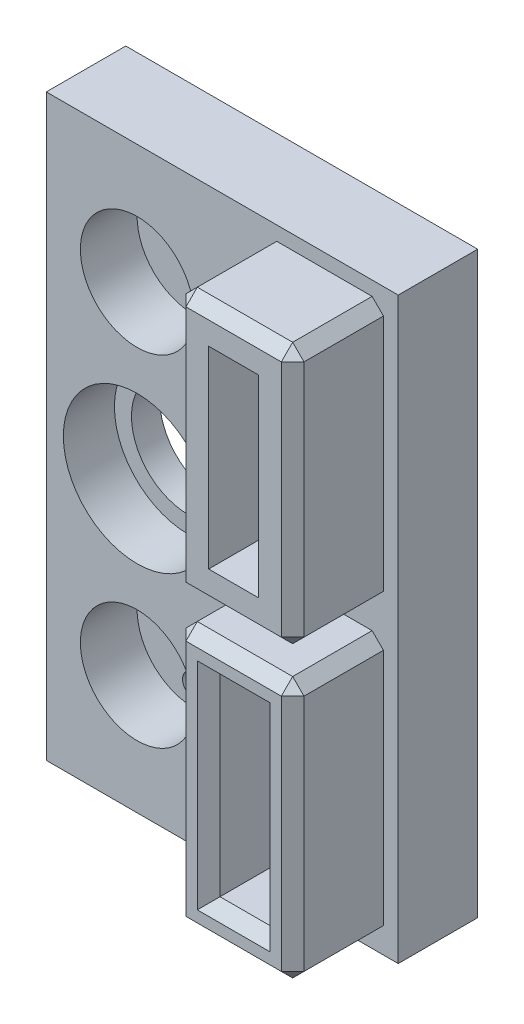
SolidWorks part; units mm, degrees
ref_plane "前视基准面" through (0, 0, 0) normal (0, 0, 1) x (1, 0, 0)
ref_plane "上视基准面" through (0, 0, 0) normal (0, 1, 0) x (1, 0, 0)
ref_plane "右视基准面" through (0, 0, 0) normal (1, 0, 0) x (0, 0, -1)
sketch "草图1" plane through (0, 0, 0) normal (0, 0, 1) x (1, 0, 0)
  line L0 (0, 0) -> (0, 15)
  line L1 (22.82, 25.8) -> (22.82, 25.5)
  line L2 (-8, 25.8) -> (22.82, 25.8)
  line L3 (-8, 25.8) -> (-8, -25.8)
  line L4 (-8, 25.8) -> (-8, -25.8)
  line L5 (-8, 25.8) -> (-8, 7.0376)
  line L6 (-8, -25.8) -> (22.82, -25.8)
  line L7 (0, 15) -> (0, -15)
  line L8 (-5, 15) -> (-8, 15)
  line L9 (-8, 15) -> (-8, 28.4964)
  line L10 (-8, 28.4964) -> (-8, -25.8)
  line L12 (22.82, 25.8) -> (22.82, -25.8)
  line L13 (-8, 25.8) -> (-8, -25.8)
  circle A0 centre (0, 15) radius 5
  circle A1 centre (0, -15) radius 5
  circle A2 centre (0, 0) radius 3
  point P0 (0, 0)
extrude "凸台-拉伸1" add sketch "草图1" along normal blind 5
sketch "草图4" plane through (0, 0, 0) normal (0, 0, -1) x (-1, 0, 0)
  line L1 (-22.8233, 25.8) -> (8, 25.8)
  line L2 (-22.8233, 25.8) -> (-22.8233, -25.8)
  line L3 (-22.8233, -25.8) -> (8, -25.8)
  line L4 (8, 25.8) -> (8, -25.8)
extrude "凸台-拉伸4" add sketch "草图4" along normal blind 2
sketch "草图5" plane through (0, 0, 0) normal (0, 0, 1) x (1, 0, 0)
  circle A0 centre (0, 0) radius 3
extrude "切除-拉伸1" cut sketch "草图5" against normal blind 10
sketch "草图6" plane through (0, 0, -2) normal (0, 0, -1) x (-1, 0, 0)
  circle A0 centre (0, 0) radius 5
extrude "切除-拉伸2" cut sketch "草图6" against normal blind 2.6
sketch "草图7" plane through (0, 0, 5) normal (0, 0, 1) x (1, 0, 0)
  circle A0 centre (0, 0) radius 6.5
extrude "切除-拉伸3" cut sketch "草图7" against normal blind 4.5
sketch "草图8" plane through (0, 0, 0) normal (0, 0, 1) x (1, 0, 0)
  circle A0 centre (0, 15) radius 1
  circle A1 centre (0, -15) radius 1
extrude "切除-拉伸4" cut sketch "草图8" against normal blind 10
sketch "草图11" plane through (0, 0, -2) normal (0, 0, -1) x (-1, 0, 0)
  line L0 (0, -15) -> (0, -18.3)
  circle A0 centre (0, -18.3) radius 1
extrude "切除-拉伸6" cut sketch "草图11" against normal blind 11
sketch "草图12" plane through (0, 0, 5) normal (0, 0, 1) x (1, 0, 0)
  line L1 (-8, -25.8) -> (22.82, -25.8)
  line L2 (-8, -25.8) -> (-8, -25.32)
  line L3 (-8, -25.32) -> (22.71, -25.32)
  line L4 (22.9793, 25.68) -> (22.71, 26.0175)
  line L5 (22.71, 25.8) -> (22.71, 31.08)
  line L6 (22.82, -25.8) -> (22.71, -25.8)
  line L7 (22.8835, 25.8) -> (26.1415, 25.8)
  line L8 (22.82, 31.08) -> (22.71, 31.08)
  line L9 (22.71, -25.32) -> (22.71, 25.68)
  line L10 (-8, 25.8) -> (22.71, 25.8)
  line L11 (-8, 25.8) -> (-8, 25.68)
  line L12 (-8, 25.68) -> (22.71, 25.68)
  line L13 (26.1415, 25.8) -> (26.1415, 25.68)
  line L14 (22.9793, 25.68) -> (26.1415, 25.68)
  line L16 (22.9793, 25.68) -> (33.8743, 25.68)
  line L18 (22.82, -25.8) -> (33.8743, -25.8)
  line L19 (33.8743, 25.68) -> (33.8743, -25.8)
extrude "切除-拉伸7" cut sketch "草图12" against normal blind 11
sketch "草图14" plane through (0, 0, -2) normal (0, 0, -1) x (-1, 0, 0)
  line L1 (-22.71, 25.68) -> (-23, 25.68)
  line L2 (-22.71, 25.68) -> (-22.71, -25.32)
  line L3 (-22.71, -25.32) -> (-23, -25.32)
  line L4 (-23, 25.68) -> (-23, -25.32)
extrude "凸台-拉伸7" add sketch "草图14" against normal up to surface (7 mm away)
sketch "草图15" plane through (0, 0, 5) normal (0, 0, 1) x (1, 0, 0)
  line L0 (0, 0) -> (23, 0)
  line L2 (23, 0) -> (23, 25.5)
  line L3 (23, 25.68) -> (23, -25.32) construction
  line L4 (23, 25.5) -> (-10.6575, 25.5)
  line L5 (-10.6575, 25.5) -> (-9.8194, 24.662)
  line L6 (23, 25.68) -> (-10.6575, 25.68)
  line L7 (23, 25.68) -> (23, 25.5)
  line L8 (23, 25.5) -> (-10.6575, 25.5)
  line L9 (-10.6575, 25.68) -> (-10.6575, 25.5)
extrude "切除-拉伸8" cut sketch "草图15" against normal blind 10 contours L6 L9 L4 M4 | L4 M6 M7 M4
sketch "草图16" plane through (0, 0, 5) normal (0, 0, 1) x (1, 0, 0)
  line L0 (-8, -25.32) -> (23, -25.32) construction
  line L1 (-8, 25.5) -> (23, 25.5)
  line L2 (-8, 25.5) -> (-8, -25.5)
  line L3 (-8, -25.5) -> (23, -25.5)
  line L4 (23, 25.5) -> (23, -25.5)
  line L5 (-8, -25.32) -> (23, -25.32)
extrude "凸台-拉伸8" add sketch "草图16" against normal up to surface (7 mm away) contours L4 L2 L3 M23
sketch "草图17" plane through (0, 0, 5) normal (0, 0, 1) x (1, 0, 0)
  line L0 (18.7, -21.25) -> (14.3, -21.25)
  line L1 (21.7, -24.25) -> (11.3, -24.25)
  line L2 (21.7, -24.25) -> (21.7, -1.25)
  line L3 (21.7, -1.25) -> (11.3, -1.25)
  line L4 (11.3, -24.25) -> (11.3, -1.25)
  line L5 (21.7, 1.25) -> (11.3, 1.25)
  line L6 (21.7, 1.25) -> (21.7, 24.25)
  line L7 (21.7, 24.25) -> (11.3, 24.25)
  line L8 (11.3, 1.25) -> (11.3, 24.25)
  line L9 (14.3, -21.25) -> (14.3, -4.25)
  line L10 (18.7, -4.25) -> (14.3, -4.25)
  line L11 (18.7, -21.25) -> (18.7, -4.25)
  line L12 (18.7, 4.25) -> (14.3, 4.25)
  line L13 (14.3, 4.25) -> (14.3, 21.25)
  line L14 (18.7, 21.25) -> (14.3, 21.25)
  line L15 (18.7, 4.25) -> (18.7, 21.25)
  dimension "D1" = 3
extrude "凸台-拉伸9" add sketch "草图17" along normal blind 8
chamfer "倒角4" distance 1 angle 45 20 edges at (14.3, -12.75, 13) (16.5, -21.25, 13) (18.7, -12.75, 13) (16.5, -4.25, 13) (16.5, -24.25, 13) (11.3, -24.25, 9) (11.3, -12.75, 13) (21.7, -24.25, 9) (21.7, -12.75, 13) (21.7, -1.25, 9) (16.5, -1.25, 13) (11.3, -1.25, 9) (16.5, 1.25, 13) (11.3, 1.25, 9) (11.3, 12.75, 13) (11.3, 24.25, 9) (16.5, 24.25, 13) (21.7, 1.25, 9) (21.7, 12.75, 13) (21.7, 24.25, 9)
